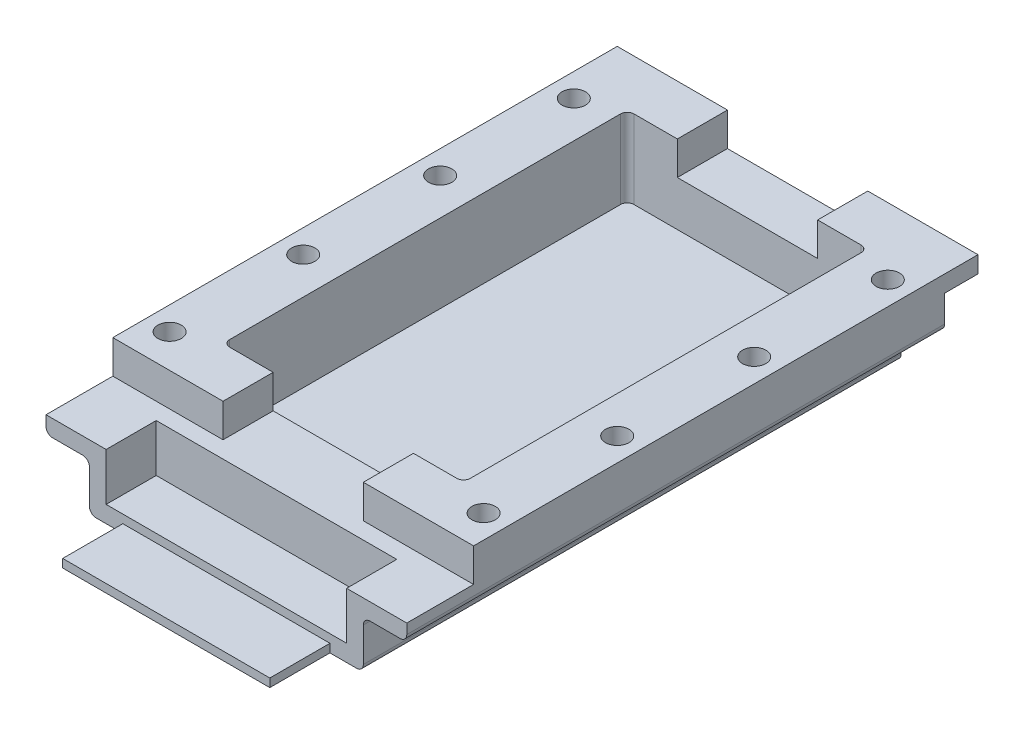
SolidWorks part; units mm, degrees
ref_plane "Alzado" through (0, 0, 0) normal (0, 0, 1) x (1, 0, 0)
ref_plane "Planta" through (0, 0, 0) normal (0, 1, 0) x (1, 0, 0)
ref_plane "Vista lateral" through (0, 0, 0) normal (1, 0, 0) x (0, 0, -1)
sketch "Croquis1" plane through (0, 0, 0) normal (0, 0, 1) x (1, 0, 0)
  line L1 (0, 0) -> (72, 0)
  line L2 (0, 0) -> (0, 23.5)
  line L3 (0, 23.5) -> (72, 23.5)
  line L4 (72, 0) -> (72, 23.5)
  dimension "D1" = 72
  dimension "D2" = 23.5
extrude "Saliente-Extruir1" add sketch "Croquis1" along normal blind 15
sketch "Croquis2" plane through (0, 0, 15) normal (0, 0, 1) x (1, 0, 0)
  line L0 (0, 23.5) -> (-18, 23.5)
  line L1 (-18, 23.5) -> (-18, 8.5)
  line L2 (-18, 8.5) -> (-5, 8.5)
  line L3 (-5, 8.5) -> (-5, -5.75)
  line L4 (-5, -5.75) -> (77, -5.75)
  line L5 (77, -5.75) -> (77, 8.5)
  line L6 (77, 8.5) -> (90, 8.5)
  line L7 (90, 8.5) -> (90, 23.5)
  line L8 (90, 23.5) -> (72, 23.5)
  line L9 (72, 23.5) -> (72, 0)
  line L10 (72, 0) -> (0, 0)
  line L11 (0, 0) -> (0, 23.5)
  dimension "D1" = 15
  dimension "D2" = 18
  dimension "D3" = 18
  dimension "D4" = 5
  dimension "D5" = 5.75
  dimension "D6" = 5
extrude "Saliente-Extruir2" add sketch "Croquis2" along normal blind 136 and the other way blind 5
sketch "Croquis6" plane through (0, 23.5, 0) normal (0, 1, 0) x (1, 0, 0)
  line L1 (0, 0) -> (-18, 0)
  line L2 (0, 0) -> (0, -10)
  line L3 (0, -10) -> (-18, -10)
  line L4 (-18, 0) -> (-18, -10)
  line L5 (72, 0) -> (90, 0)
  line L6 (72, 0) -> (72, -10)
  line L7 (72, -10) -> (90, -10)
  line L8 (90, 0) -> (90, -10)
extrude "Saliente-Extruir6" add sketch "Croquis6" against normal blind 5
sketch "Croquis7" plane through (0, -5.75, 0) normal (0, -1, 0) x (1, 0, 0)
  line L0 (-5, 10) -> (77, 10) construction
  line L1 (5, 28) -> (67, 28)
  line L2 (5, 28) -> (5, 10)
  line L3 (5, 10) -> (67, 10)
  line L4 (67, 28) -> (67, 10)
  line L5 (67, 10) -> (67, 28) construction
extrude "Cortar-Extruir1" cut sketch "Croquis7" against normal blind 2.5
ref_plane "Plano1" through (36, 0, 0) normal (1, 0, 0) x (0, 0, -1)
sketch "Croquis8" plane through (0, 23.5, 0) normal (0, 1, 0) x (1, 0, 0)
  line L0 (0, -15) -> (0, -151) construction
  line L1 (72, -151) -> (0, -151)
  line L2 (72, -151) -> (72, -136)
  line L3 (72, -136) -> (0, -136)
  line L4 (0, -151) -> (0, -136)
  dimension "D1" = 15
extrude "Saliente-Extruir7" add sketch "Croquis8" against normal up to next
sketch "Croquis9" plane through (0, 0, 151) normal (0, 0, 1) x (1, 0, 0)
  line L0 (-18, 13.5) -> (90, 13.5)
  line L1 (-18, 23.5) -> (-18, 8.5) construction
  line L2 (90, 8.5) -> (90, 23.5) construction
  line L3 (90, 13.5) -> (90, 8.5)
  line L4 (90, 8.5) -> (77, 8.5)
  line L5 (77, 8.5) -> (77, -5.75)
  line L6 (77, -5.75) -> (-5, -5.75)
  line L7 (-5, -5.75) -> (-5, 8.5)
  line L8 (-5, 8.5) -> (-18, 8.5)
  line L9 (-18, 8.5) -> (-18, 13.5)
  dimension "D1" = 5
extrude "Saliente-Extruir8" add sketch "Croquis9" along normal blind 20
sketch "Croquis10" plane through (0, 0, 171) normal (0, 0, 1) x (1, 0, 0)
  line L0 (90, 13.5) -> (-18, 13.5) construction
  line L1 (0, 13.5) -> (72, 13.5)
  line L2 (0, 13.5) -> (0, -0.75)
  line L3 (0, -0.75) -> (72, -0.75)
  line L4 (72, 13.5) -> (72, -0.75)
  line L5 (77, -5.75) -> (77, 8.5) construction
  line L6 (-5, 8.5) -> (-5, -5.75) construction
  line L7 (-5, -5.75) -> (77, -5.75) construction
  dimension "D1" = 5
  dimension "D2" = 5
  dimension "D3" = 5
extrude "Cortar-Extruir2" cut sketch "Croquis10" against normal blind 15
sketch "Croquis11" plane through (0, -5.75, 0) normal (0, -1, 0) x (1, 0, 0)
  line L0 (-5, 171) -> (77, 171) construction
  line L1 (5, 171) -> (67, 171)
  line L2 (5, 171) -> (5, 189)
  line L3 (5, 189) -> (67, 189)
  line L4 (67, 171) -> (67, 189)
  line L5 (67, 10) -> (67, 28) construction
  line L6 (5, 28) -> (5, 10) construction
  dimension "D1" = 18
extrude "Saliente-Extruir9" add sketch "Croquis11" against normal blind 2.5 contours L4 L3 L2 L1
fillet "Redondeo8" radius 2 6 edges at (90, 8.5, 90.5) (77, -5.75, 90.5) (-18, 8.5, 90.5) (-5, 8.5, 90.5) (-5, -5.75, 90.5) (77, 8.5, 90.5)
sketch "Croquis13" plane through (0, 23.5, 0) normal (0, 1, 0) x (1, 0, 0)
  line L0 (90, 0) -> (-18, 0) construction
  line L1 (57, 0) -> (15, 0)
  line L2 (57, 0) -> (57, -171)
  line L3 (57, -171) -> (15, -171)
  line L4 (15, 0) -> (15, -171)
  line L5 (90, -171) -> (72, -171) construction
  line L6 (72, -156) -> (72, -171) construction
  line L7 (0, -156) -> (0, -171) construction
  dimension "D1" = 15
  dimension "D2" = 15
extrude "Cortar-Extruir6" cut sketch "Croquis13" against normal blind 10
sketch "Croquis14" plane through (0, 0, 0) normal (0, 0, -1) x (-1, 0, 0)
  line L0 (0, 0) -> (-72, 0) construction
  line L1 (-70, 0) -> (-75, 0)
  line L2 (-70, 0) -> (-70, 15)
  line L3 (-70, 15) -> (-75, 15)
  line L4 (-75, 0) -> (-75, 15)
  dimension "D1" = 15
  dimension "D2" = 5
extrude "Cortar-Extruir7" cut sketch "Croquis14" against normal blind 30
fillet "Redondeo9" radius 2 3 edges at (73.5, 15, 30) (75, 15, 20) (75, 7.5, 30)
fillet "Redondeo10" radius 2 4 edges at (72, 11.75, 136) (0, 11.75, 136) (0, 11.75, 15) (72, 19.25, 15)
sketch "Croquis15" plane through (0, 23.5, 0) normal (0, 1, 0) x (1, 0, 0)
  line L0 (-11, -181) -> (-11, 20) construction
  line L2 (83, 20) -> (83, -181) construction
  line L3 (83, -20) -> (-11, -20) construction
  line L4 (90, 0) -> (57, 0) construction
  line L5 (83, -60) -> (-11, -60) construction
  line L6 (90, -171) -> (72, -171) construction
  line L7 (83, -101) -> (-11, -101) construction
  line L9 (83, -141) -> (-11, -141) construction
  circle A0 centre (83, -20) radius 3.5
  circle A1 centre (83, -60) radius 3.5
  circle A2 centre (83, -101) radius 3.5
  circle A3 centre (83, -141) radius 3.5
  circle A4 centre (-11, -20) radius 3.5
  circle A5 centre (-11, -60) radius 3.5
  circle A6 centre (-11, -101) radius 3.5
  circle A7 centre (-11, -141) radius 3.5
  dimension "D5" = 7
  dimension "D6" = 7
  dimension "D7" = 7
  dimension "D8" = 7
  dimension "D9" = 7
  dimension "D10" = 7
  dimension "D11" = 7
  dimension "D12" = 7
  dimension "D1" = 20
  dimension "D2" = 30
  dimension "D3" = 40
  dimension "D4" = 40
extrude "Cortar-Extruir8" cut sketch "Croquis15" against normal through all
sketch "Croquis16" plane through (0, 8.5, 0) normal (0, -1, 0) x (1, 0, 0)
  line L0 (88.25, 141) -> (88.25, 101) construction
  line L1 (88.25, 101) -> (88.25, 60) construction
  line L2 (88.25, 60) -> (88.25, 20) construction
  line L4 (-16.25, 20) -> (-16.25, 60) construction
  line L5 (-16.25, 60) -> (-16.25, 101) construction
  line L6 (-16.25, 101) -> (-16.25, 141) construction
  circle A0 centre (-11, 141) radius 5.25
  circle A1 centre (-11, 101) radius 5.25
  circle A2 centre (-11, 60) radius 5.25
  circle A3 centre (-11, 20) radius 5.25
  circle A4 centre (83, 20) radius 5.25
  circle A5 centre (83, 60) radius 5.25
  circle A6 centre (83, 101) radius 5.25
  circle A7 centre (83, 141) radius 5.25
  dimension "D1" = 10.5
  dimension "D2" = 10.5
extrude "Cortar-Extruir9" cut sketch "Croquis16" against normal blind 7 and the other way blind 10
